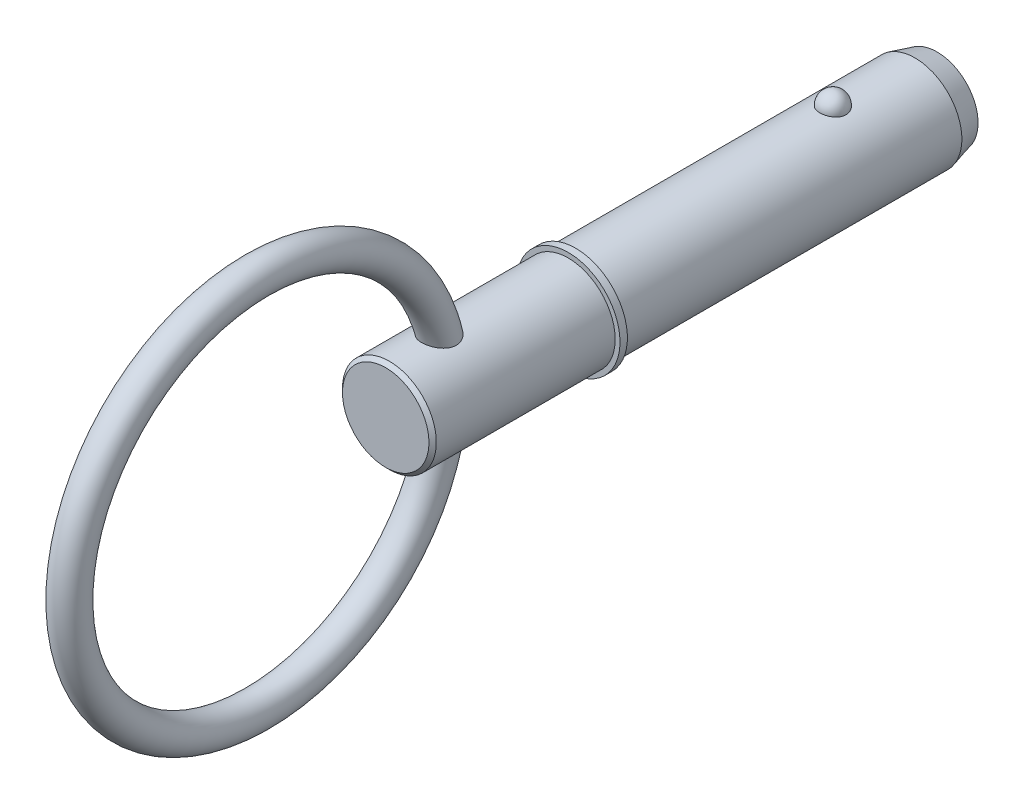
SolidWorks part; units mm, degrees
ref_plane "Front Plane" through (0, 0, 0) normal (0, 0, 1) x (1, 0, 0)
ref_plane "Top Plane" through (0, 0, 0) normal (0, 1, 0) x (1, 0, 0)
ref_plane "Right Plane" through (0, 0, 0) normal (1, 0, 0) x (0, 0, -1)
sketch "Sketch2" plane through (0, 0, 0) normal (0, 0, 1) x (1, 0, 0)
  circle A0 centre (0, 0) radius 6.35
  point P3 (0, 6.35)
  dimension "D1" = 12.7
extrude "Boss-Extrude1" add sketch "Sketch2" along normal blind 33.02
sketch "Sketch3" plane through (0, 0, 0) normal (0, 0, -1) x (-1, 0, 0)
  circle A0 centre (0, 0) radius 6.35
  dimension "D1" = 12.7
extrude "Boss-Extrude2" add sketch "Sketch3" along normal blind 15.88
chamfer "Chamfer1" distance 3 angle 15 1 edges at (-6.35, 0, -15.88)
sketch "Sketch18" plane through (0, 0, 0) normal (1, 0, 0) x (0, 0, -1)
  line L0 (12.88, 6.35) -> (-33.02, 6.35) construction
  line L1 (1.78, 8.13) -> (1.78, 4.57)
  line L2 (-33.02, -6.35) -> (12.88, -6.35) construction
  arc A0 (1.78, 8.13) -> (1.78, 4.57) centre (1.78, 6.35) ccw
  point P4 (0, 6.35)
  dimension "D1" = 14.48
revolve "Revolve1" add sketch "Sketch18" angle 360 about L1
sketch "Sketch19" plane through (0, 0, 0) normal (1, 0, 0) x (0, 0, -1)
  line L0 (-33.7288, 0) -> (-46.4542, 0) construction
sketch "Sketch20" plane through (0, 0, 0) normal (1, 0, 0) x (0, 0, -1)
  line L0 (-33.02, 0) -> (-33.02, 7)
  line L1 (-33.02, 6.35) -> (-33.02, -6.35) construction
  line L2 (-33.02, 7) -> (-34.02, 7)
  line L3 (-34.02, 7) -> (-34.02, 0)
  line L4 (-33.7288, 0) -> (-46.4542, 0) construction
  line L5 (-34.02, 0) -> (-33.02, 0)
  dimension "D1" = 7
  dimension "D2" = 1
revolve "Revolve2" add sketch "Sketch20" angle 360 about L0
sketch "Sketch21" plane through (0, 0, 33.02) normal (0, 0, -1) x (-1, 0, 0)
  circle A0 centre (0, 0) radius 6.35
  dimension "D1" = 12.7
extrude "Boss-Extrude3" add sketch "Sketch21" against normal blind 25.7
chamfer "Chamfer2" distance 0.5 angle 45 1 edges at (-6.35, 0, 58.72)
sketch "Sketch23" plane through (0, 0, 0) normal (1, 0, 0) x (0, 0, -1)
  line L0 (-58.72, 5.85) -> (-58.72, -5.85) construction
  circle A0 centre (-76.12, 0) radius 25.4
  point P2 (-50.72, 0)
  dimension "D1" = 50.8
  dimension "D2" = 8
sketch "Sketch24" plane through (0, 0, 0) normal (0, 1, 0) x (1, 0, 0)
  circle A0 centre (0, -50.72) radius 2.25
  dimension "D1" = 4.5
sweep "Sweep1" add profiles "Sketch24" path "Sketch23"
